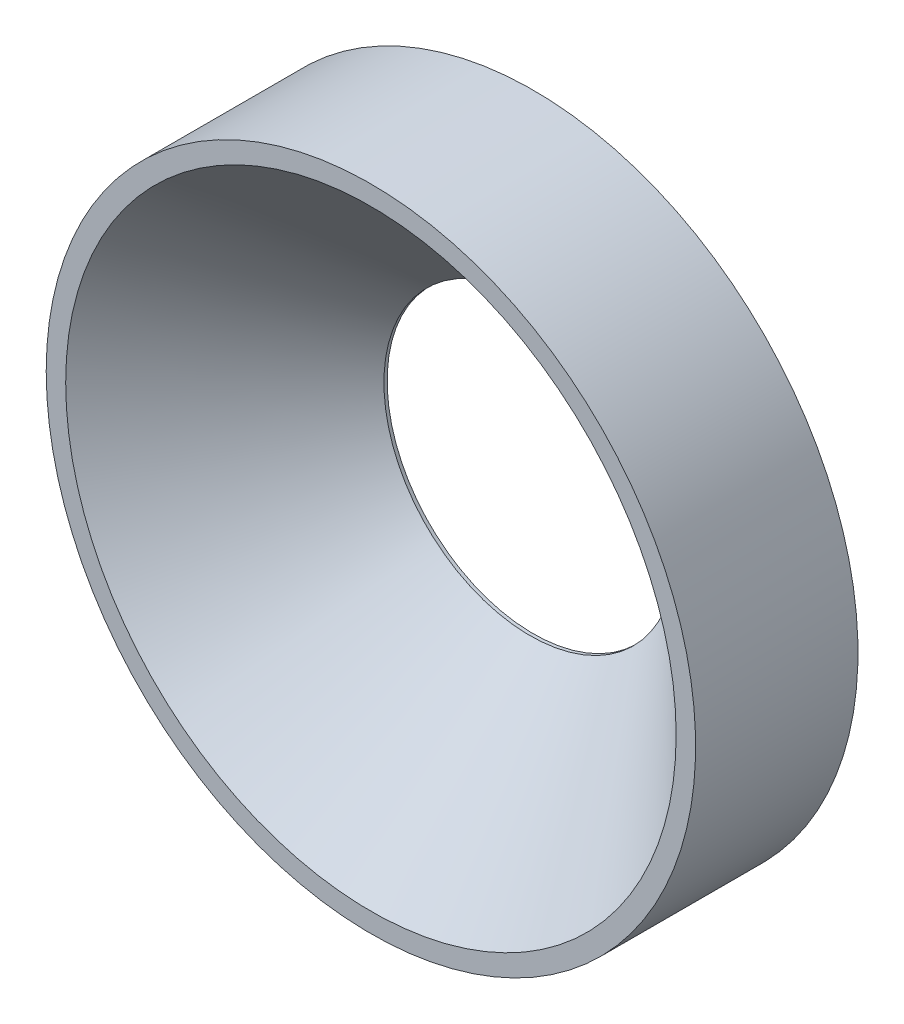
SolidWorks part; units mm, degrees
ref_plane "Face" through (0, 0, 0) normal (0, 0, 1) x (1, 0, 0)
ref_plane "Dessus" through (0, 0, 0) normal (0, 1, 0) x (1, 0, 0)
ref_plane "Droite" through (0, 0, 0) normal (1, 0, 0) x (0, 0, -1)
sketch "Esquisse1" plane through (0, 0, 0) normal (0, 0, 1) x (1, 0, 0)
  circle A0 centre (0, 0) radius 5
  dimension "D1" = 10
extrude "Extrusion1" add sketch "Esquisse1" along normal blind 2.5
hole_wizard "Fraisage pour vis à tête fraisée à fond plat M41" positions "Esquisse7" profile "Esquisse6" countersink size "M4" standard "ISO"
sketch "Esquisse7" plane through (0, 0, 2.5) normal (0, 0, 1) x (1, 0, 0)
  point P0 (0, 0)
sketch "Esquisse6" plane through (0, 0, 2.5) normal (1, 0, 0) x (0, -1, 0)
  line L0 (0, 0) -> (0, 11.3519)
  line L1 (0, 11.3519) -> (2.25, 10)
  line L2 (2.25, 10) -> (2.25, 2.45)
  line L3 (2.25, 2.45) -> (4.7, 0)
  line L5 (4.7, 0) -> (0, 0)
  line L6 (-2.25, 2.45) -> (-4.7, 0) construction
  line L10 (0, 11.3519) -> (-2.25, 10) construction
  line L11 (0, -6.35) -> (0, 107.95) construction
  dimension "Diamètre du perçage" = 4.5
  dimension "Profondeur du perçage" = 10
  dimension "Diamètre du fraisage entrant" = 9.4
  dimension "Angle du fraisage entrant" = 90
  dimension "Angle de pointe" = 118
